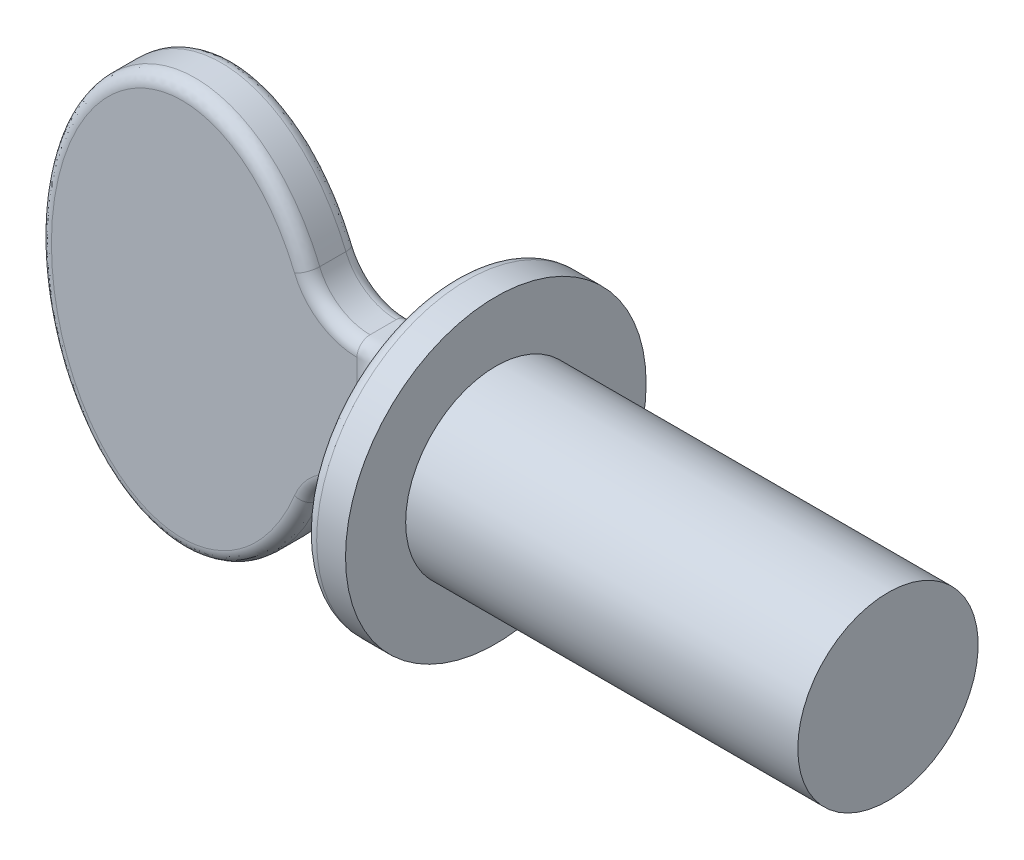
SolidWorks part; units mm, degrees
ref_plane "Front Plane" through (0, 0, 0) normal (0, 0, 1) x (1, 0, 0)
ref_plane "Top Plane" through (0, 0, 0) normal (0, 1, 0) x (1, 0, 0)
ref_plane "Right Plane" through (0, 0, 0) normal (1, 0, 0) x (0, 0, -1)
other "Configuration Table"
sketch "layout" plane through (0, 0, 0) normal (0, 0, 1) x (1, 0, 0)
  line L0 (0, 0) -> (13.208, 0) construction
  line L1 (5.588, 2.921) -> (5.588, -2.921)
  line L2 (3.3976, 1.3123) -> (4.8921, 1.3123) construction
  line L3 (5.588, 2.921) -> (4.7897, 2.921)
  line L4 (4.7897, 2.921) -> (4.7897, 3.2655) construction
  line L5 (4.2865, 1.706) -> (4.2865, 0)
  line L6 (4.2865, 1.706) -> (3.3355, 0.7551) construction
  line L7 (13.208, 1.7526) -> (13.208, 0)
  line L8 (3.3976, 1.3123) -> (3.3976, -1.3123)
  line L9 (13.208, 1.7526) -> (5.588, 1.7526)
  arc A0 (3.3976, 1.3123) -> (2.4197, 1.9685) centre (3.3976, 2.3692) cw
  arc A1 (4.7897, 2.921) -> (4.2865, 1.706) centre (3.0715, 2.921) cw
  arc A2 (3.3976, -1.3123) -> (2.4197, -1.9685) centre (3.3976, -2.3692) ccw
  ellipse E0 centre (0, 0) end of major axis (0, 3.937) minor radius 2.794 (2.4197, 1.9685) -> (2.4197, -1.9685) ccw
sketch "Sketch3" plane through (0, 0, 0) normal (0, 0, 1) x (1, 0, 0)
  line L0 (3.3976, 1.3123) -> (3.3976, -1.3123) construction
  line L1 (3.3976, 1.3123) -> (3.3976, -1.3123)
  arc A0 (3.3976, -1.3123) -> (2.4197, -1.9685) centre (3.3976, -2.3692) ccw construction
  arc A1 (2.4197, 1.9685) -> (3.3976, 1.3123) centre (3.3976, 2.3692) ccw construction
  arc A2 (3.3976, -1.3123) -> (2.4197, -1.9685) centre (3.3976, -2.3692) ccw
  arc A3 (2.4197, 1.9685) -> (3.3976, 1.3123) centre (3.3976, 2.3692) ccw
  ellipse E0 centre (0, 0) end of major axis (0, 3.937) minor radius 2.794 (2.4197, 1.9685) -> (2.4197, -1.9685) ccw construction
  ellipse E1 centre (0, 0) end of major axis (0, 3.937) minor radius 2.794 (2.4197, 1.9685) -> (2.4197, -1.9685) ccw
extrude "Extrude1" add sketch "Sketch3" along normal mid plane 1.016
fillet "Fillet1" radius 0.254 6 edges at (2.8088, 1.4916, -0.508) (2.8088, -1.4916, -0.508) (2.8088, 1.4916, 0.508) (2.8088, -1.4916, 0.508) (-2.794, 0, -0.508) (-2.794, 0, 0.508)
sketch "Sketch4" plane through (0, 0, 0) normal (0, 0, 1) x (1, 0, 0)
  line L1 (13.208, 1.7526) -> (5.588, 1.7526) construction
  line L2 (5.588, 2.921) -> (5.588, -2.921) construction
  line L3 (5.588, 2.921) -> (4.7897, 2.921) construction
  line L4 (4.2865, 1.706) -> (4.2865, 0) construction
  line L5 (13.208, 1.7526) -> (13.208, 0) construction
  line L6 (13.208, 1.7526) -> (5.588, 1.7526)
  line L7 (5.588, 2.921) -> (5.588, 1.7526)
  line L8 (5.588, 2.921) -> (4.7897, 2.921)
  line L9 (4.2865, 1.706) -> (4.2865, 0)
  line L10 (0, 0) -> (16.8942, 0) construction
  line L11 (13.208, 0) -> (4.2865, 0)
  line L12 (13.208, 1.7526) -> (13.208, 0)
  arc A0 (4.2865, 1.706) -> (4.7897, 2.921) centre (3.0715, 2.921) ccw construction
  arc A1 (4.2865, 1.706) -> (4.7897, 2.921) centre (3.0715, 2.921) ccw
revolve "Revolve1" add sketch "Sketch4" angle 360 about L10
loft "Loft1" add
fillet "Fillet2" radius 0.254 1 edges at (4.7897, 0, 2.921)
sketch "Sketch5" plane through (0, 0, 0) normal (0, 1, 0) x (1, 0, 0)
  line L0 (12.6625, 2.2981) -> (13.208, 2.2981)
  line L1 (13.208, 2.2981) -> (13.208, 1.7526)
  line L2 (13.208, 1.7526) -> (12.9352, 1.2802)
  line L3 (12.9352, 1.2802) -> (12.6625, 1.7526)
  line L4 (13.208, -1.7526) -> (13.208, 1.7526) construction
  line L5 (12.6625, 1.7526) -> (12.6625, 2.2981)
  line L6 (13.208, 1.7526) -> (5.588, 1.7526) construction
  line L7 (-3.6147, 0) -> (14.1406, 0) construction
revolve "Cut-Revolve10" [suppressed] cut sketch "Sketch5" angle 360 about L7
pattern_linear "LPattern10" [suppressed] count 9 along (1, 0, 0)
equation "\"D4@layout\" = \"Head Height@layout\" / 3 * 2"
equation "\"D5@layout\" = \"Head Width@layout\" / 3"
equation "\"D6@layout\" = \"Head Width@layout\" / 2"
equation "\"D7@layout\" = \"D5@layout\" * 1.3"
equation "\"D8@layout\" = \"D4@layout\"  / 7"
equation "\"D1@Fillet1\" = \"Head Thickness@Extrude1\" / 4"
equation "\"D1@Fillet2\" = \"D1@Fillet1\""
equation "\"D1@Sketch5\" = ( \"Base Screw Dia@layout\"- \"Minor Dia@Cosmetic Thread1\" )  / 2"
equation "\"D1@LPattern10\" = int((\"Length@layout\")/\"Advance@LPattern10\")"
